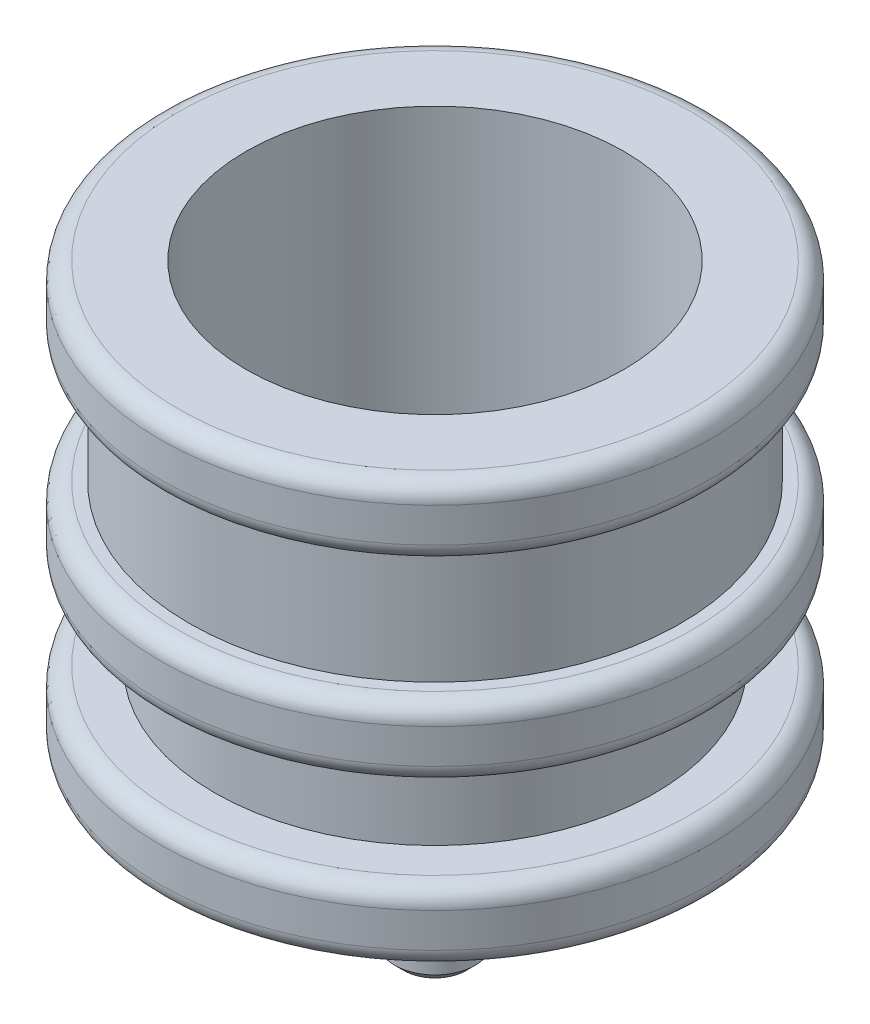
SolidWorks part; units mm, degrees
ref_plane "Front Plane" through (0, 0, 0) normal (0, 0, 1) x (1, 0, 0)
ref_plane "Top Plane" through (0, 0, 0) normal (0, 1, 0) x (1, 0, 0)
ref_plane "Right Plane" through (0, 0, 0) normal (1, 0, 0) x (0, 0, -1)
sketch "Sketch1" plane through (0, 0, 0) normal (0, 0, 1) x (1, 0, 0)
  line L0 (0, 11.0481) -> (0, -5.2098) construction
  line L1 (0, -55) -> (0, 55) construction
  line L2 (3.915, 2.27) -> (3.915, 3.27)
  line L3 (3.5, 5) -> (3.5, 3.27)
  line L4 (3.915, 0) -> (3.915, 1)
  line L5 (3.915, 1) -> (3.14, 1)
  line L6 (3.14, 1) -> (3.14, 2.27)
  line L7 (3.14, 2.27) -> (3.915, 2.27)
  line L8 (3.915, 6) -> (3.915, 5)
  line L9 (3.915, 6) -> (0, 6)
  line L11 (3.915, 5) -> (3.5, 5)
  line L13 (3.5, 3.27) -> (3.915, 3.27)
  line L14 (0, 6) -> (0, 0)
  line L19 (0, 0) -> (3.915, 0)
revolve "Revolve1" add sketch "Sketch1" angle 360 about L0
hole_wizard "M2.5x0.45 Tapped Hole1" positions "Sketch6" profile "Sketch5" tap size "M2.5x0.45" standard "ANSI Metric"
sketch "Sketch6" plane through (0, 6, 0) normal (0, 1, 0) x (1, 0, 0)
  point P0 (0, 0)
sketch "Sketch5" plane through (0, 6, 0) normal (1, 0, 0) x (0, 0, 1)
  line L0 (0, 0) -> (0, 4.8159)
  line L1 (0, 4.8159) -> (1.025, 4.2)
  line L2 (1.025, 4.2) -> (1.025, 0)
  line L5 (1.025, 0) -> (0, 0)
  line L10 (0, 4.8159) -> (-1.025, 4.2) construction
  line L11 (0, -6.35) -> (0, 107.95) construction
  dimension "Tap Drill Dia." = 2.05
  dimension "Tap Drill Depth" = 4.2
  dimension "Drill Angle" = 118
sketch "Sketch7" plane through (0, 6, 0) normal (0, 1, 0) x (1, 0, 0)
  circle A0 centre (0, 0) radius 2.6924
  circle A3 centre (0, 0) radius 3.915 construction
  dimension "D1" = 5.3848
extrude "Cut-Extrude1" cut sketch "Sketch7" against normal blind 4.5
fillet "Fillet1" radius 0.254 6 edges at (0, 0, 3.915) (0, 1, 3.915) (0, 2.27, 3.915) (0, 3.27, 3.915) (0, 5, 3.915) (0, 6, 3.915)
sketch "Sketch8" plane through (0, 0, 0) normal (0, -1, 0) x (1, 0, 0)
  circle A0 centre (0, 0) radius 0.5715
  dimension "D1" = 1.143
extrude "Boss-Extrude1" add sketch "Sketch8" along normal blind 2.54
chamfer "Chamfer1" distance 0.127 angle 45 1 edges at (0, -2.54, -0.5715)
equation "\"D7@Sketch1\"=\"D4@Sketch1\""
equation "\"D8@Sketch1\"=\"D4@Sketch1\""
